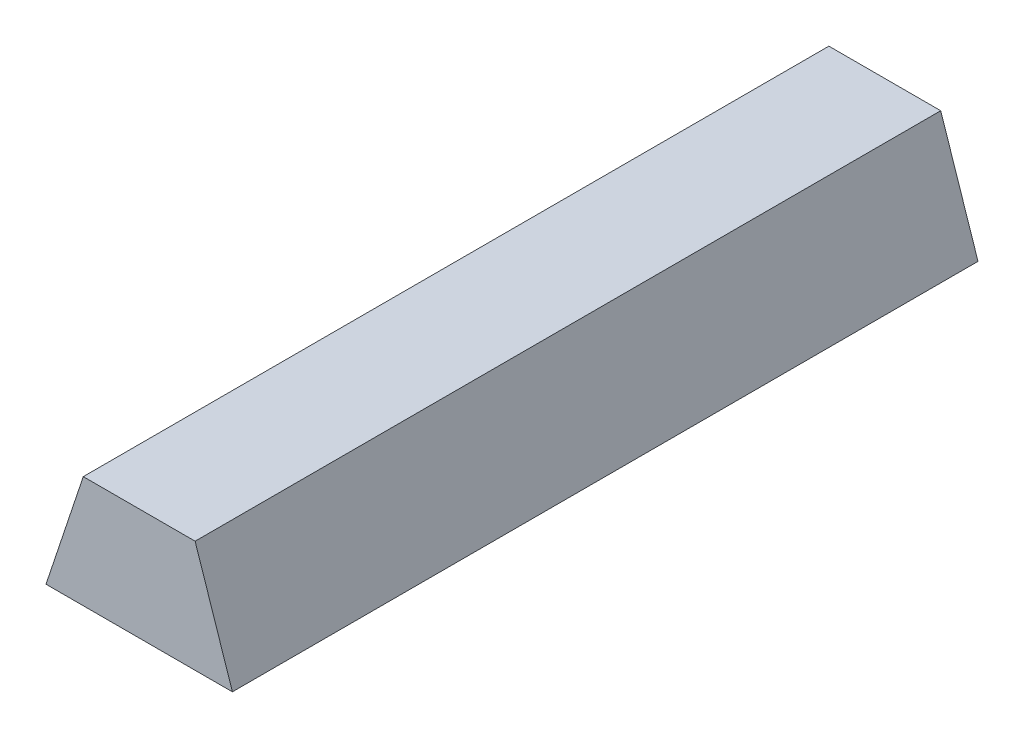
SolidWorks part; units mm, degrees
ref_plane "前视基准面" through (0, 0, 0) normal (0, 0, 1) x (1, 0, 0)
ref_plane "上视基准面" through (0, 0, 0) normal (0, 1, 0) x (1, 0, 0)
ref_plane "右视基准面" through (0, 0, 0) normal (1, 0, 0) x (0, 0, -1)
sketch "草图1" plane through (0, 0, 0) normal (0, 0, 1) x (1, 0, 0)
  line L0 (-150, 150) -> (150, 150)
  line L1 (-250, 150) -> (250, 150)
  line L2 (-250, 150) -> (-250, -150)
  line L3 (-250, -150) -> (250, -150)
  line L4 (250, 150) -> (250, -150)
  line L5 (-250, 150) -> (250, -150) construction
  line L6 (-250, -150) -> (250, 150) construction
  line L7 (-150, 150) -> (-250, -150)
  line L8 (150, 150) -> (250, -150)
  point P0 (0, 0)
  point P9 (0, 150)
  dimension "D1" = 500
  dimension "D2" = 300
  dimension "D3" = 300
extrude "凸台-拉伸1" add sketch "草图1" along normal blind 2000 contours L8 L0 L7 L3
